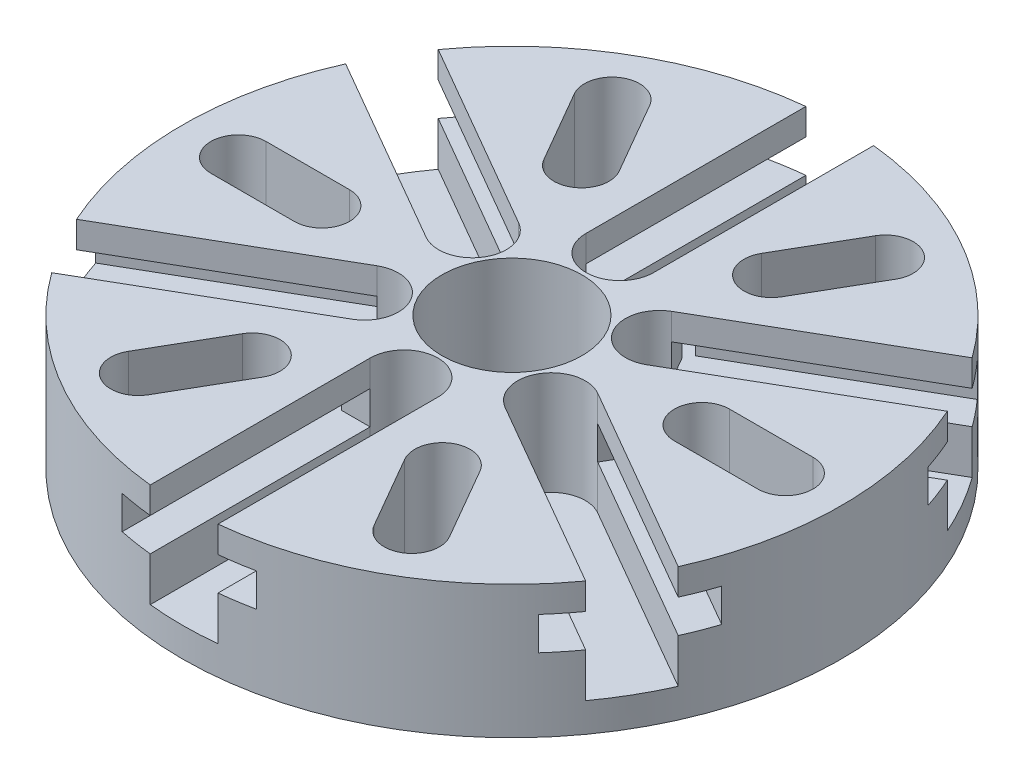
SolidWorks part; units mm, degrees
ref_plane "Front Plane" through (0, 0, 0) normal (0, 0, 1) x (1, 0, 0)
ref_plane "Top Plane" through (0, 0, 0) normal (0, 1, 0) x (1, 0, 0)
ref_plane "Right Plane" through (0, 0, 0) normal (1, 0, 0) x (0, 0, -1)
ref_plane "Plane1" through (0, 0, 31.496) normal (0, 0, 1) x (1, 0, 0)
sketch "Sketch1" plane through (0, 0, 0) normal (0, 1, 0) x (1, 0, 0)
  circle A0 centre (0, 0) radius 31.496
  dimension "D1" = 62.992
extrude "Extrude1" add sketch "Sketch1" along normal blind 12.7
sketch "Sketch2" plane through (0, 0, 31.496) normal (0, 0, 1) x (1, 0, 0)
  line L0 (-3.2385, 12.7) -> (3.2385, 12.7)
  line L1 (3.2385, 12.7) -> (3.2385, 10.1727)
  line L2 (3.2385, 10.1727) -> (6.4135, 10.1727)
  line L3 (6.4135, 10.1727) -> (6.4135, 6.9977)
  line L4 (6.4135, 6.9977) -> (3.2385, 6.9977)
  line L5 (3.2385, 6.9977) -> (3.2385, 2.794)
  line L6 (3.2385, 2.794) -> (-3.2385, 2.794)
  line L7 (-3.2385, 2.794) -> (-3.2385, 6.9977)
  line L8 (-3.2385, 6.9977) -> (-6.4135, 6.9977)
  line L9 (-6.4135, 6.9977) -> (-6.4135, 10.1727)
  line L10 (-6.4135, 10.1727) -> (-3.2385, 10.1727)
  line L11 (-3.2385, 10.1727) -> (-3.2385, 12.7)
  line L12 (31.496, 12.7) -> (-31.496, 12.7) construction
  line L13 (0, 0) -> (0, 15.9804) construction
  point P16 (0, 12.7)
  point P17 (6.4135, 8.5852)
  dimension "D1" = 6.477
  dimension "D2" = 4.1148
  dimension "D7" = 3.175
  dimension "D10" = 9.906
  dimension "D11" = 12.827
extrude "Cut-Extrude1" cut sketch "Sketch2" against normal blind 21.1836
sketch "Sketch10" plane through (0, 12.7, 0) normal (0, 1, 0) x (1, 0, 0)
  line L0 (3.2385, -31.3291) -> (3.2385, -10.3124) construction
  line L1 (3.2385, -10.3124) -> (-3.2385, -10.3124) construction
  circle A0 centre (0, -10.3124) radius 3.2385
extrude "Cut-Extrude14" cut sketch "Sketch10" against normal up to surface (9.906 mm away)
sketch "Sketch7" plane through (0, 12.7, 0) normal (0, 1, 0) x (1, 0, 0)
  line L2 (18.161, -2.6353) -> (26.1366, -2.6353)
  line L3 (18.161, 2.3813) -> (26.1366, 2.3813) construction
  line L4 (18.161, -2.3813) -> (26.1366, -2.3813) construction
  line L5 (18.161, 2.6353) -> (26.1366, 2.6353)
  arc A0 (18.161, 2.3813) -> (18.161, -2.3813) centre (18.161, 0) ccw construction
  arc A1 (26.1366, -2.3813) -> (26.1366, 2.3813) centre (26.1366, 0) ccw construction
  arc A4 (18.161, 2.6353) -> (18.161, -2.6353) centre (18.161, 0) ccw
  arc A5 (26.1366, -2.6353) -> (26.1366, 2.6353) centre (26.1366, 0) ccw
  dimension "D1" = 18.161
  dimension "D2" = 7.9756
  dimension "D3" = 0.254
  dimension "D4" = 4.7625
extrude "Cut-Extrude12" cut sketch "Sketch7" against normal through all
sketch "Sketch8" plane through (0, 12.7, 0) normal (0, 1, 0) x (1, 0, 0)
  circle A0 centre (0, 0) radius 6.6967
  circle A1 centre (0, 0) radius 31.496 construction
  dimension "D1" = 13.3934
extrude "Cut-Extrude13" cut sketch "Sketch8" against normal blind 9.906
pattern_circular "CirPattern2" count 6 over 360 about axis through (0, 0, 0) along (0, 1, 0) of "Cut-Extrude1", "Cut-Extrude14", "Cut-Extrude12"
ref_plane "Plane2" through (0, 0, 0) normal (0, 0, 1) x (1, 0, 0)
